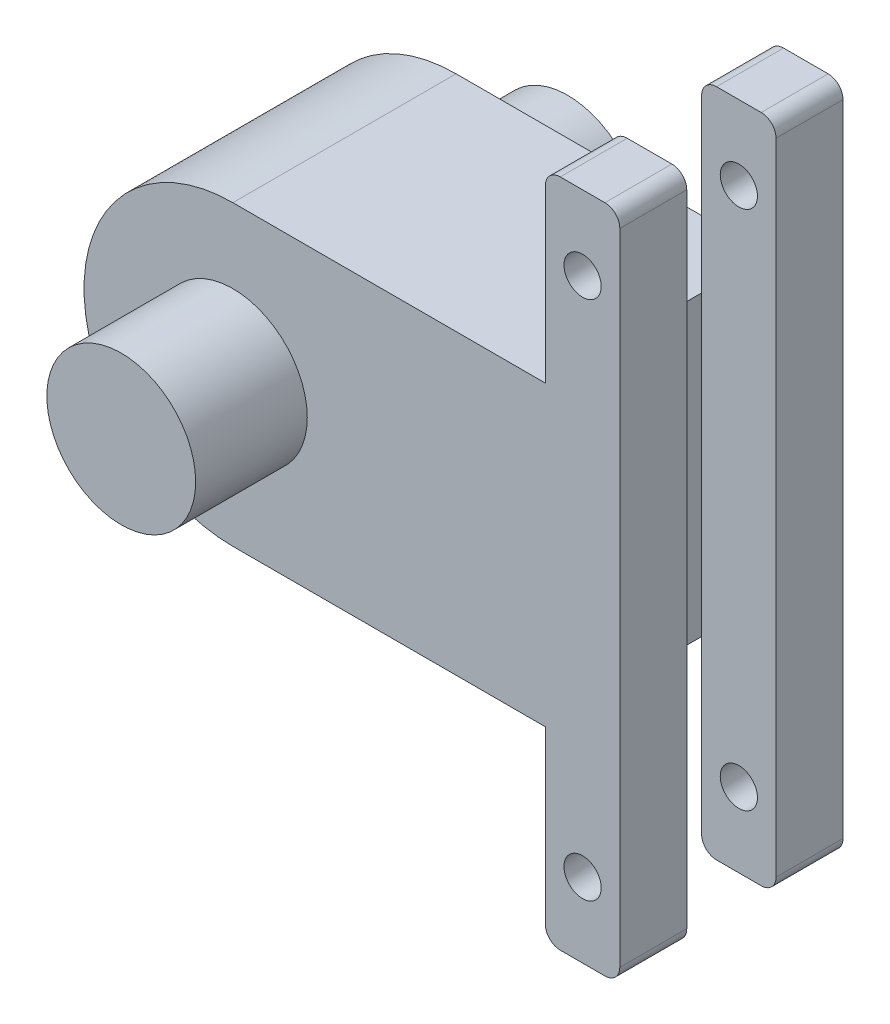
SolidWorks part; units mm, degrees
ref_plane "Front Plane" through (0, 0, 0) normal (0, 0, 1) x (1, 0, 0)
ref_plane "Top Plane" through (0, 0, 0) normal (0, 1, 0) x (1, 0, 0)
ref_plane "Right Plane" through (0, 0, 0) normal (1, 0, 0) x (0, 0, -1)
sketch "Sketch1" plane through (0, 0, 0) normal (0, 0, 1) x (1, 0, 0)
  line L0 (0, 0) -> (-42, 0) construction
  line L1 (0, -45) -> (0, -20)
  line L2 (0, 45) -> (10, 45)
  line L3 (10, 45) -> (10, -45)
  line L4 (10, -45) -> (0, -45)
  line L5 (-42, 20) -> (0, 20)
  line L6 (-42, -20) -> (0, -20)
  line L7 (0, 20) -> (0, 45)
  arc A0 (-42, 20) -> (-42, -20) centre (-42, 0) ccw
  circle A1 centre (5, 35) radius 2.5
  circle A2 centre (5, -35) radius 2.5
  point P7 (0, 0)
  dimension "D2" = 40
  dimension "D5" = 5
  dimension "D1" = 42
  dimension "D3" = 90
  dimension "D4" = 10
  dimension "D6" = 10
extrude "Boss-Extrude1" add sketch "Sketch1" along normal blind 30
sketch "Sketch2" plane through (0, 0, 30) normal (0, 0, 1) x (1, 0, 0)
  circle A0 centre (-42, 0) radius 10
  dimension "D1" = 20
extrude "Boss-Extrude2" add sketch "Sketch2" along normal blind 15
ref_plane "Plane1" through (0, 0, 15) normal (0, 0, 1) x (1, 0, 0)
mirror "Mirror1" about plane through (0, 0, 15) normal (0, 0, 1) of "Boss-Extrude2"
sketch "Sketch4" plane through (0, -45, 0) normal (0, -1, 0) x (1, 0, 0)
  line L0 (10, 15) -> (0, 15) construction
  line L1 (10, 30) -> (10, 0) construction
  line L2 (0, 30) -> (0, 0) construction
  line L4 (0, 9) -> (10, 9)
  line L5 (0, 9) -> (0, 21)
  line L6 (0, 21) -> (10, 21)
  line L7 (10, 9) -> (10, 21)
  line L8 (0, 9) -> (10, 21) construction
  line L9 (0, 21) -> (10, 9) construction
  point P6 (5, 15)
  dimension "D1" = 12
extrude "Cut-Extrude1" cut sketch "Sketch4" against normal through all
fillet "Fillet1" radius 2 8 edges at (10, -45, 4.5) (0, -45, 4.5) (0, -45, 25.5) (10, -45, 25.5) (0, 45, 4.5) (10, 45, 4.5) (10, 45, 25.5) (0, 45, 25.5)
